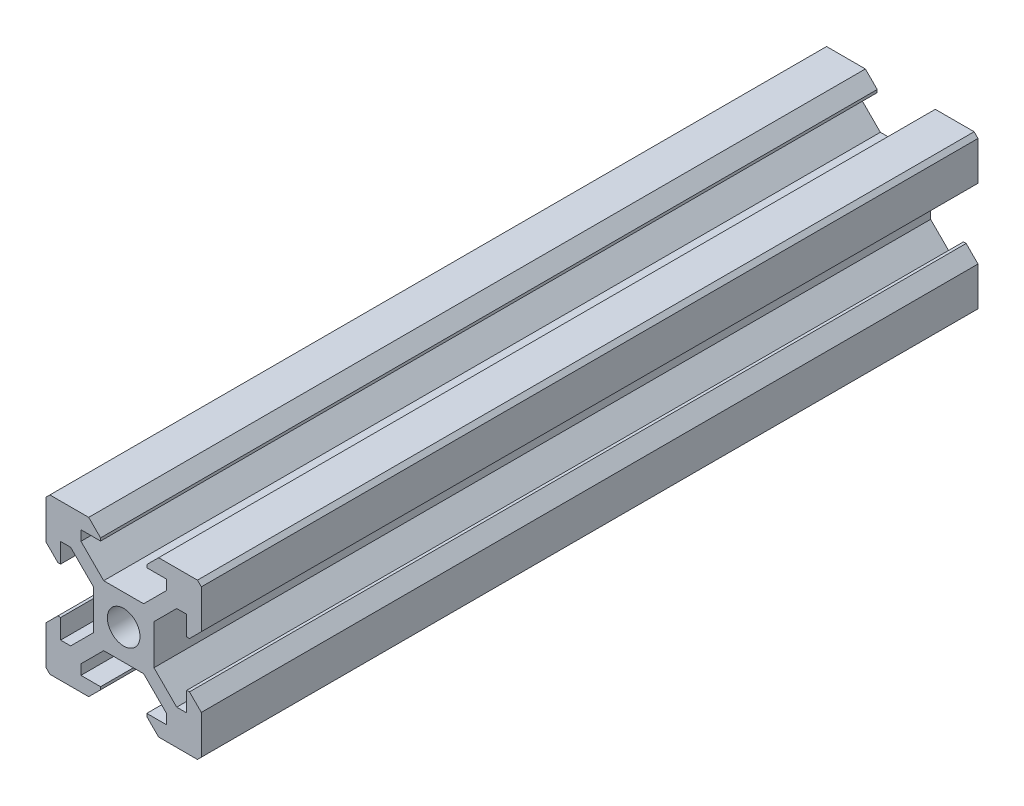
SolidWorks part; units mm, degrees
ref_plane "Front Plane" through (0, 0, 0) normal (0, 0, 1) x (1, 0, 0)
ref_plane "Top Plane" through (0, 0, 0) normal (0, 1, 0) x (1, 0, 0)
ref_plane "Right Plane" through (0, 0, 0) normal (1, 0, 0) x (0, 0, -1)
sketch "Sketch1" plane through (0, 0, 0) normal (0, 0, 1) x (1, 0, 0)
  line L0 (15.6876, 55.3211) -> (115.0437, 55.3211) construction
  line L1 (5.5, 6.8294) -> (2.5706, 3.9)
  line L2 (0, 3.9) -> (0, 2.1)
  line L3 (10, 10) -> (1.4849, 1.4849)
  line L4 (10, 10) -> (4.5, 10)
  line L5 (1.4849, 1.4849) -> (3.9, 3.9) construction
  line L6 (10, -10) -> (-10, 10) construction
  line L7 (10, 10) -> (1.4849, 1.4849) construction
  line L8 (0, 0) -> (-10, -10) construction
  line L10 (0, 3.9) -> (2.5706, 3.9)
  line L12 (-3.9, -3.9) -> (0, 0) construction
  line L13 (-3.9, 3.9) -> (3.9, -3.9) construction
  line L14 (5.5, 6.8294) -> (5.5, 8.12)
  line L15 (5.5, 8.12) -> (2.62, 8.12)
  line L16 (2.62, 8.12) -> (4.5, 10)
  line L17 (0, 2.1) -> (0, 16.7618) construction
  arc A0 (1.4849, 1.4849) -> (0, 2.1) centre (0, 0) ccw
  point P2 (0, 0)
  point P7 (0, 0)
  dimension "D3" = 45
  dimension "D4" = 6.1
  dimension "D8" = 4.2
  dimension "D1" = 20
  dimension "D2" = 11
  dimension "D5" = 1.88
  dimension "D6" = 9
  dimension "D7" = 0.94
  dimension "D9" = 3.9
extrude "Boss-Extrude1" add sketch "Sketch1" along normal blind 100
chamfer "Chamfer2" distance 0.5 angle 45 1 edges at (2.62, 8.12, 50)
mirror "Mirror1" about plane through (10, 10, 100) normal (-0.7071, 0.7071, 0)
chamfer "Chamfer1" distance 0.5 angle 45 1 edges at (10, 10, 50)
mirror "Mirror4" about plane through (0, 3.9, 100) normal (1, 0, 0)
mirror "Mirror5" about plane through (-3.9, 0, 100) normal (0, 1, 0)
